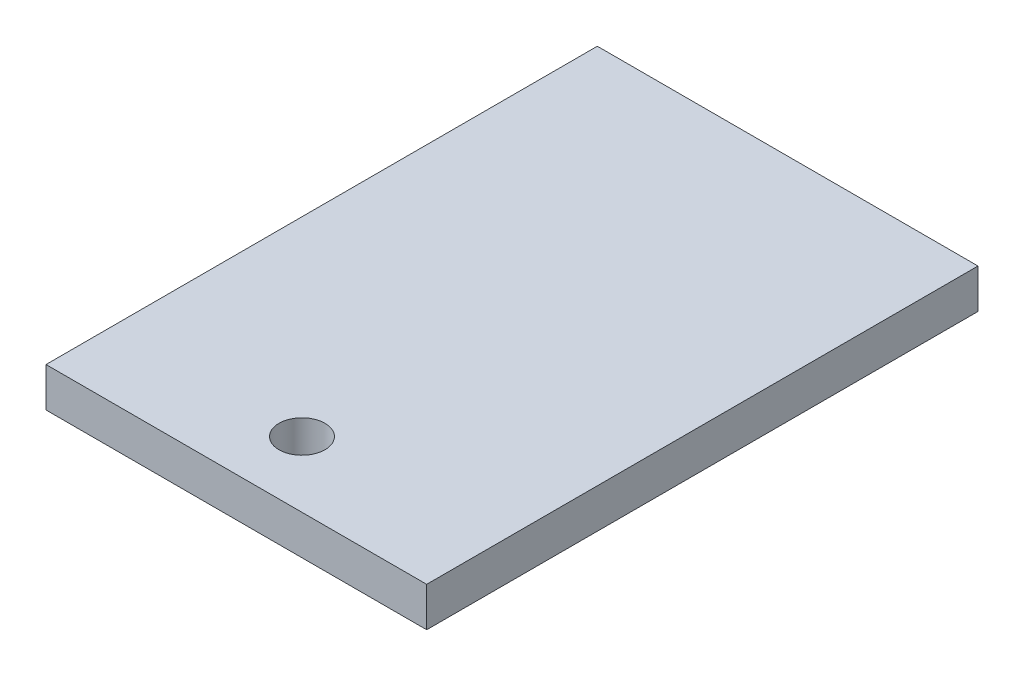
SolidWorks part; units mm, degrees
ref_plane "Front" through (0, 0, 0) normal (0, 0, 1) x (1, 0, 0)
ref_plane "Top" through (0, 0, 0) normal (0, 1, 0) x (1, 0, 0)
ref_plane "Right" through (0, 0, 0) normal (1, 0, 0) x (0, 0, -1)
sketch "Sketch1" plane through (0, 0, 0) normal (0, 1, 0) x (1, 0, 0)
  line L1 (0, 0) -> (29, 0)
  line L2 (0, 0) -> (0, 42)
  line L3 (0, 42) -> (29, 42)
  line L4 (29, 0) -> (29, 42)
  circle A0 centre (14.5, 5) radius 1.75
  dimension "D1" = 29
  dimension "D2" = 14.5
extrude "Extrude1" add sketch "Sketch1" along normal blind 3
